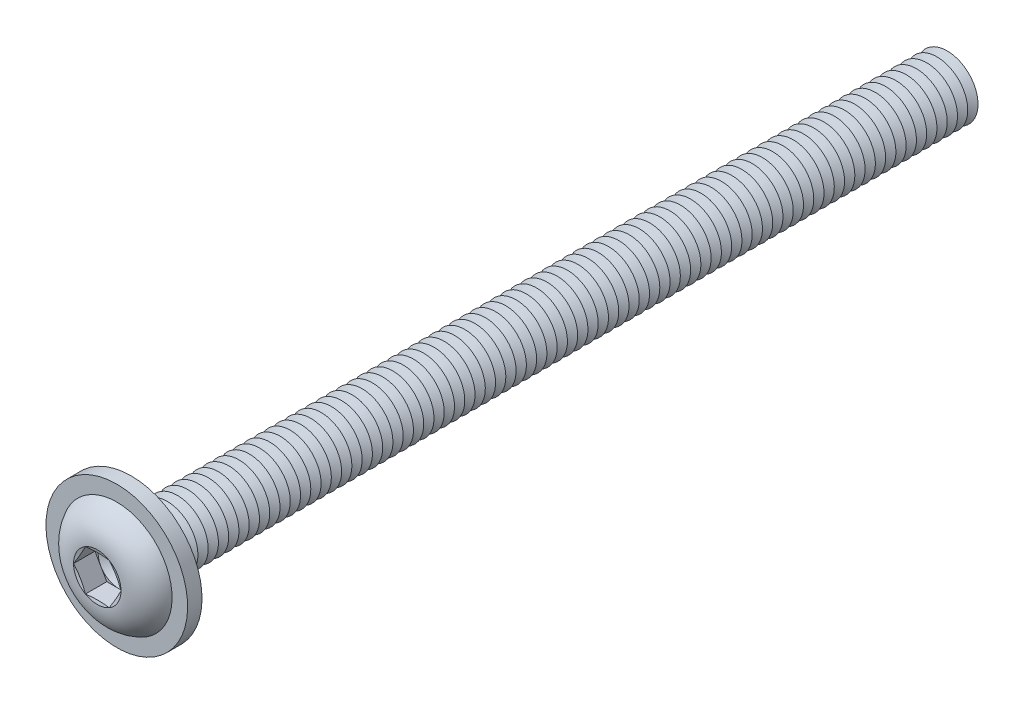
SolidWorks part; units mm, degrees
ref_plane "Front Plane" through (0, 0, 0) normal (0, 0, 1) x (1, 0, 0)
ref_plane "Top Plane" through (0, 0, 0) normal (0, 1, 0) x (1, 0, 0)
ref_plane "Right Plane" through (0, 0, 0) normal (1, 0, 0) x (0, 0, -1)
sketch "Sketch1" plane through (0, 0, 0) normal (1, 0, 0) x (0, 0, -1)
  line L0 (0, 1.5) -> (0, 2.85)
  line L3 (0, 1.5) -> (40, 1.5)
  line L4 (40, 1.5) -> (40, 0)
  line L5 (40, 0) -> (-1.65, 0) construction
  line L6 (-1.65, 0) -> (40, 0)
  line L7 (-1.65, 1.1547) -> (-1.65, 0.5773) construction
  line L8 (-1.65, 0.5773) -> (-1.65, 0)
  line L9 (-1.65, 1.1547) -> (-1.4953, 0.5773)
  line L10 (-1.4953, 0.5773) -> (-1.65, 0.5773)
  line L11 (40, 0) -> (22.7481, 0) construction
  line L12 (0, 2.85) -> (-1.65, 2.85) construction
  arc A1 (0, 2.85) -> (-1.65, 1.1547) centre (0, 1.1994) ccw
  point P8 (40, 0.75)
  dimension "D1" = 5.7
  dimension "D2" = 3
  dimension "D3" = 1.65
  dimension "D4" = 2.3094
  dimension "D5" = 40
  dimension "D6" = 15
revolve "Revolve1" add sketch "Sketch1" angle 360 about L5
fillet "Fillet1" radius 0.25 1 edges at (0, 1.5, 0)
sketch "Sketch2" plane through (0, 0, 0) normal (1, 0, 0) x (0, 0, -1)
  line L0 (39.75, 1.5) -> (40.25, 1.5)
  line L1 (40, 1.5) -> (0.25, 1.5) construction
  line L2 (40.25, 1.5) -> (40, 1.067)
  line L3 (40, -1.5) -> (40, 1.5) construction
  line L4 (40, 1.067) -> (39.75, 1.5)
  dimension "D1" = 0.5
revolve "Cut-Revolve1" cut sketch "Sketch2" angle 360 about axis through (0, 0, -40) along (0, 0, -1)
pattern_linear "LPattern1" count 80 spacing 0.5 along (0, 0, 1) of "Cut-Revolve1"
sketch "Sketch3" plane through (0, 0, 1.65) normal (0, 0, 1) x (1, 0, 0)
  line L7 (0.5773, 1) -> (-0.5774, 1)
  line L8 (-0.5774, 1) -> (-1.1547, 0)
  line L9 (-1.1547, 0) -> (-0.5773, -1)
  line L10 (-0.5773, -1) -> (0.5773, -1)
  line L11 (0.5773, -1) -> (1.1547, 0)
  line L12 (1.1547, 0) -> (0.5773, 1)
  circle A0 centre (0, 0) radius 1 construction
  circle A3 centre (0, 0) radius 1.1547 construction
extrude "Cut-Extrude1" cut sketch "Sketch3" against normal blind 1.04
sketch "Sketch4" plane through (0, 0, 0.61) normal (0, 0, 1) x (1, 0, 0)
  line L1 (0.5773, 1) -> (-0.5774, 1) construction
  circle A0 centre (0, 0) radius 1
extrude "Cut-Extrude2" cut sketch "Sketch4" against normal through all draft 60
sketch "Sketch5" plane through (0, 0, 0) normal (0, 0, -1) x (-1, 0, 0)
  circle A0 centre (0, 0) radius 3.45
  circle A1 centre (0, 0) radius 1.75
  circle A2 centre (0, 0) radius 1.75 construction
  dimension "D1" = 6.9
extrude "Boss-Extrude1" add sketch "Sketch5" against normal blind 0.7
